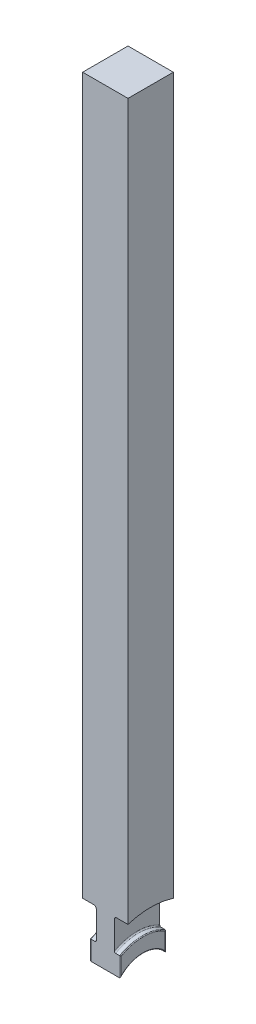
SolidWorks part; units mm, degrees
ref_plane "Front Plane" through (0, 0, 0) normal (0, 0, 1) x (1, 0, 0)
ref_plane "Top Plane" through (0, 0, 0) normal (0, 1, 0) x (1, 0, 0)
ref_plane "Right Plane" through (0, 0, 0) normal (1, 0, 0) x (0, 0, -1)
sketch "Sketch1" plane through (0, 0, 0) normal (1, 0, 0) x (0, 0, -1)
  line L0 (-7.5, 260) -> (-7.5, 0)
  line L1 (0, 249.2329) -> (0, 0) construction
  line L2 (7.5, 260) -> (7.5, 0)
  line L3 (-7.5, 260) -> (7.5, 260)
  line L6 (-7.5, 0) -> (7.5, 0)
  arc A0 (-10, 0) -> (10, 0) centre (0, 0) cw construction
  dimension "R" = 10
  dimension "L" = 250
  dimension "T" = 15
extrude "Boss-Extrude1" add sketch "Sketch1" along normal mid plane 15
sketch "Sketch8" plane through (0, 0, 0) normal (1, 0, 0) x (0, 0, -1)
  circle A0 centre (0, 0) radius 10
  arc A1 (10, 0) -> (-10, 0) centre (0, 0) ccw construction
extrude "Cut-Extrude4" cut sketch "Sketch8" against normal through all both and the other way through all
sketch "Sketch2" plane through (0, 0, 0) normal (0, 0, 1) x (1, 0, 0)
  line L0 (7.5, 15) -> (3, 15)
  line L1 (7.5, 260) -> (7.5, 6.6144) construction
  line L2 (3, 15) -> (3, 24.5)
  line L3 (3, 24.5) -> (7.5, 24.5)
  line L4 (7.5, 24.5) -> (7.5, 15)
  line L5 (0, 29.9173) -> (0, 0) construction
  line L6 (-7.5, 24.5) -> (-7.5, 15)
  line L7 (-3, 24.5) -> (-7.5, 24.5)
  line L8 (-3, 15) -> (-3, 24.5)
  line L9 (-7.5, 15) -> (-3, 15)
  line L10 (-8.8482, 0) -> (24.5305, 0) construction
  dimension "D1" = 6
  dimension "D2" = 24.5
  dimension "D3" = 15
revolve "Cut-Revolve1" cut sketch "Sketch2" angle 360 about L10
sketch "Sketch7" plane through (0, 0, 0) normal (0, 0, 1) x (1, 0, 0)
  line L6 (-7.5, 15) -> (-5, 15)
  line L8 (-7.5, 15) -> (-7.5, 0)
  line L9 (-7.5, 0) -> (-5, 0)
  line L10 (-5, 15) -> (-5, 0)
  line L11 (0, 16.5651) -> (0, 5.9342) construction
  line L12 (5, 15) -> (5, 0)
  line L13 (7.5, 0) -> (5, 0)
  line L14 (7.5, 15) -> (7.5, 0)
  line L15 (7.5, 15) -> (5, 15)
  dimension "MW" = 10
extrude "Cut-Extrude3" cut sketch "Sketch7" against normal through all both and the other way through all
fillet "Fillet1" radius 0.762 2 edges at (-3, 24.5, 0) (3, 24.5, 0)
fillet "Fillet2" radius 0.381 2 edges at (-3, 15, 0) (3, 15, 0)
fillet "Fillet3" radius 0.25 8 edges at (-5, 10, 0) (-5, 9.8024, -7.5) (-5, 15, 0) (-5, 9.8024, 7.5) (5, 10, 0) (5, 9.8024, 7.5) (5, 15, 0) (5, 9.8024, -7.5)
